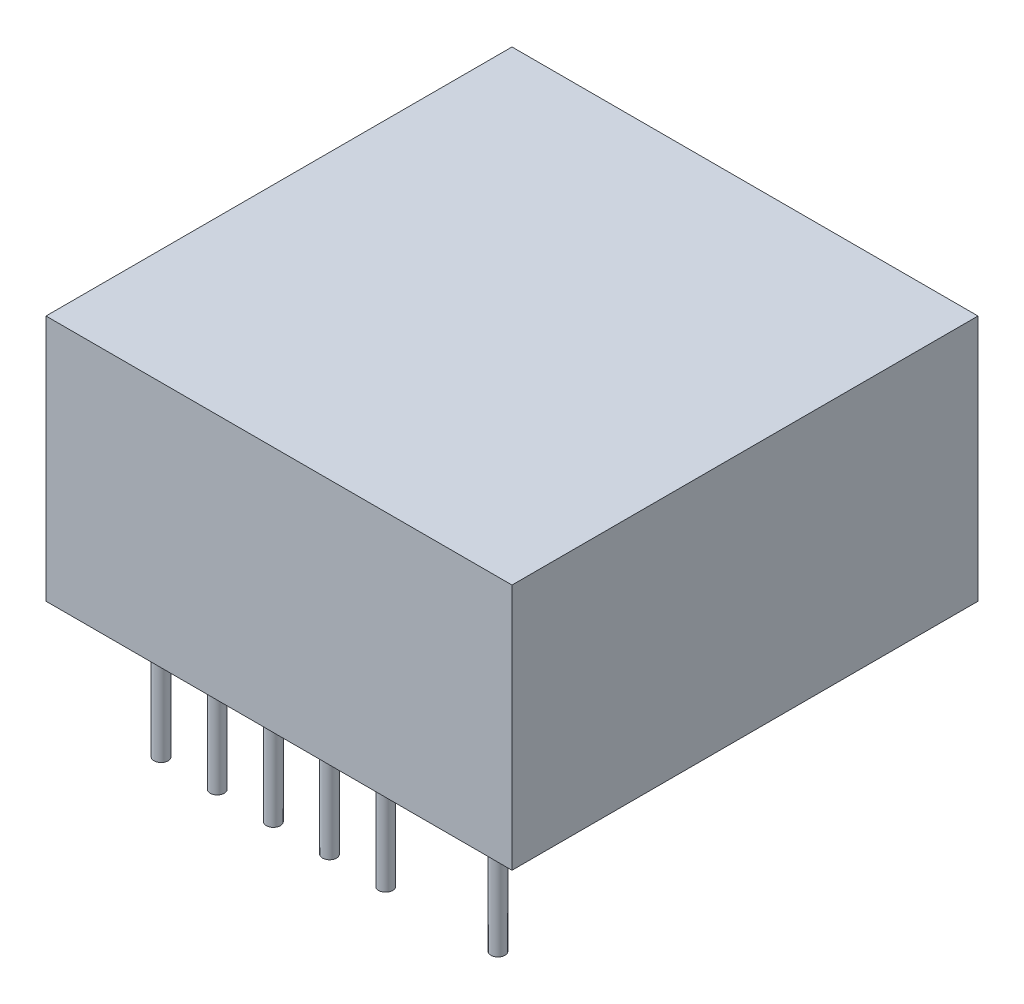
SolidWorks part; units mm, degrees
ref_plane "Front Plane" through (0, 0, 0) normal (0, 0, 1) x (1, 0, 0)
ref_plane "Top Plane" through (0, 0, 0) normal (0, 1, 0) x (1, 0, 0)
ref_plane "Right Plane" through (0, 0, 0) normal (1, 0, 0) x (0, 0, -1)
sketch "Sketch1" plane through (0, 0, 0) normal (0, 1, 0) x (1, 0, 0)
  line L1 (0, 0) -> (21.082, 0)
  line L2 (0, 0) -> (0, 21.082)
  line L3 (0, 21.082) -> (21.082, 21.082)
  line L4 (21.082, 0) -> (21.082, 21.082)
extrude "Boss-Extrude1" add sketch "Sketch1" along normal blind 11.176
sketch "Sketch2" plane through (0, 0, 0) normal (0, -1, 0) x (1, 0, 0)
  line L0 (0, -2.032) -> (2.54, -2.032) construction
  line L1 (0, -21.082) -> (0, 0) construction
  line L2 (2.54, -2.032) -> (2.54, 0) construction
  line L3 (0, 0) -> (21.082, 0) construction
  line L4 (2.54, -2.032) -> (5.08, -2.032) construction
  line L9 (5.08, -2.032) -> (7.62, -2.032) construction
  line L10 (7.62, -2.032) -> (10.16, -2.032) construction
  line L11 (10.16, -2.032) -> (12.7, -2.032) construction
  line L12 (12.7, -2.032) -> (15.24, -2.032) construction
  line L13 (15.24, -2.032) -> (17.78, -2.032) construction
  circle A0 centre (2.8575, -2.3495) radius 0.3175
  circle A1 centre (5.3975, -2.3495) radius 0.3175
  circle A2 centre (7.9375, -2.3495) radius 0.3175
  circle A3 centre (10.4775, -2.3495) radius 0.3175
  circle A4 centre (13.0175, -2.3495) radius 0.3175
  circle A5 centre (18.0975, -2.3495) radius 0.3175
extrude "Boss-Extrude2" add sketch "Sketch2" along normal blind 5.842
